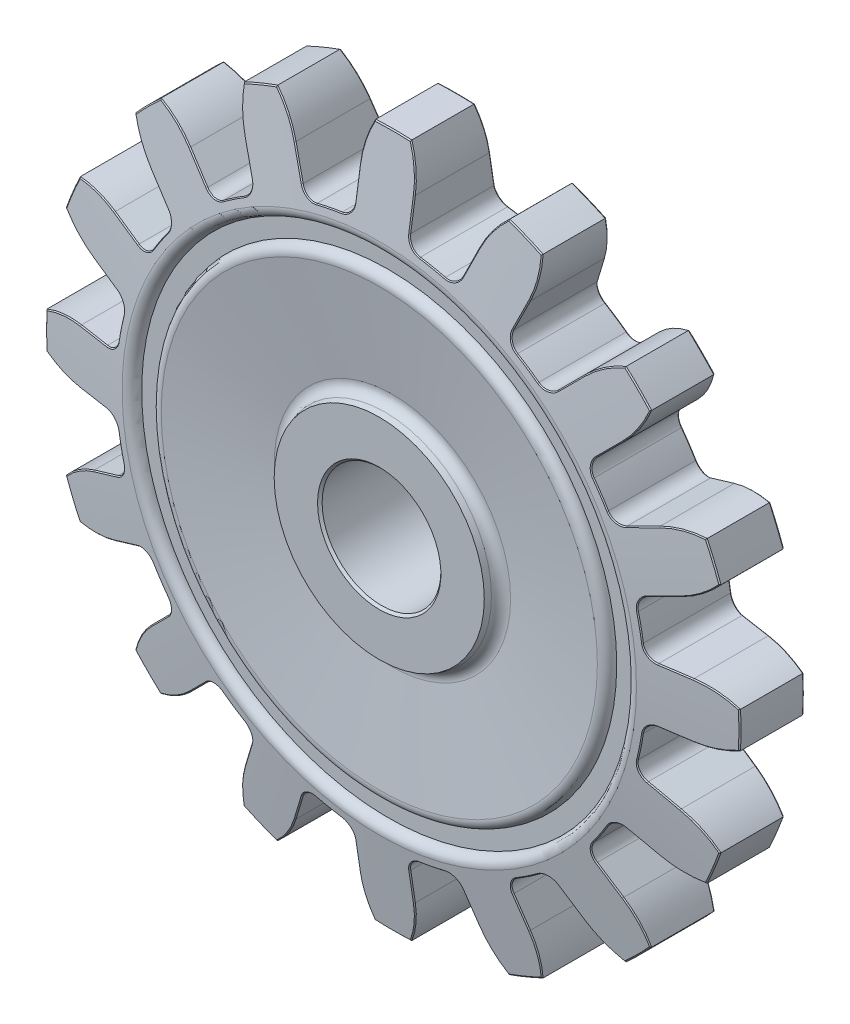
SolidWorks part; units mm, degrees
ref_plane "Спереди" through (0, 0, 0) normal (0, 0, 1) x (1, 0, 0)
ref_plane "Сверху" through (0, 0, 0) normal (0, 1, 0) x (1, 0, 0)
ref_plane "Справа" through (0, 0, 0) normal (1, 0, 0) x (0, 0, -1)
sketch "Эскиз2" plane through (0, 0, 0) normal (1, 0, 0) x (0, 0, -1)
  line L0 (-9.4803, 0) -> (8.8412, 0) construction
  line L1 (-5, 6.5) -> (5, 6.5)
  line L2 (5, 6.5) -> (5, 11.5)
  line L3 (-3.5, 38) -> (3.5, 38)
  line L4 (0, 0) -> (0, 38) construction
  line L5 (4, 27) -> (4, 25)
  line L6 (5, 11.5) -> (5, 40.25) construction
  line L7 (3.5, 38) -> (4.9888, 28.1494)
  line L8 (5, 11.5) -> (4.3844, 11.6707)
  line L9 (4.9914, 23.8695) -> (3.5512, 12.9296)
  line L10 (-5, 6.5) -> (-5, 11.5)
  line L11 (-5, 11.5) -> (-4.3844, 11.6707)
  line L12 (-4.9914, 23.8695) -> (-3.5512, 12.9296)
  line L13 (-4, 27) -> (-4, 25)
  line L14 (-3.5, 38) -> (-4.9888, 28.1494)
  arc A0 (4, 27) -> (4.9888, 28.1494) centre (4, 28) ccw
  arc A1 (4.9914, 23.8695) -> (4, 25) centre (4, 24) ccw
  arc A2 (3.5512, 12.9296) -> (4.3844, 11.6707) centre (4.6919, 12.7794) ccw
  arc A3 (-3.5512, 12.9296) -> (-4.3844, 11.6707) centre (-4.6919, 12.7794) cw
  arc A4 (-4.9914, 23.8695) -> (-4, 25) centre (-4, 24) cw
  arc A5 (-4, 27) -> (-4.9888, 28.1494) centre (-4, 28) cw
  point P19 (0, 6.5)
  dimension "D8" = 2
  dimension "D1" = 6.5
  dimension "D2" = 11.5
  dimension "D3" = 5
  dimension "D4" = 38
  dimension "D5" = 3.5
  dimension "D6" = 2
  dimension "D7" = 11
  dimension "D9" = 4
  dimension "D10" = 15.5
  dimension "D11" = 7.5
  dimension "D12" = 12.7794
revolve "Повернуть1" add sketch "Эскиз2" angle 360 about L0
sketch "Эскиз3" plane through (0, 0, 0) normal (0, 0, 1) x (1, 0, 0)
  line L0 (0, 42.1478) -> (0, 0) construction
  line L1 (0, 0) -> (7, 33.527) construction
  line L2 (3, 33.527) -> (3, 30.1662)
  line L3 (-3, 33.527) -> (-3, 30.1662)
  line L4 (15.6019, 29.8269) -> (14.3157, 26.7219)
  line L5 (10.0586, 32.123) -> (8.7725, 29.018)
  line L6 (25.8285, 21.5859) -> (23.452, 19.2094)
  line L7 (21.5859, 25.8285) -> (19.2094, 23.452)
  line L8 (32.123, 10.0586) -> (29.018, 8.7725)
  line L9 (29.8269, 15.6019) -> (26.7219, 14.3157)
  line L10 (33.527, -3) -> (30.1662, -3)
  line L11 (33.527, 3) -> (30.1662, 3)
  line L12 (29.8269, -15.6019) -> (26.7219, -14.3157)
  line L13 (32.123, -10.0586) -> (29.018, -8.7725)
  line L14 (21.5859, -25.8285) -> (19.2094, -23.452)
  line L15 (25.8285, -21.5859) -> (23.452, -19.2094)
  line L16 (10.0586, -32.123) -> (8.7725, -29.018)
  line L17 (15.6019, -29.8269) -> (14.3157, -26.7219)
  line L18 (-3, -33.527) -> (-3, -30.1662)
  line L19 (3, -33.527) -> (3, -30.1662)
  line L20 (-15.6019, -29.8269) -> (-14.3157, -26.7219)
  line L21 (-10.0586, -32.123) -> (-8.7725, -29.018)
  line L22 (-25.8285, -21.5859) -> (-23.452, -19.2094)
  line L23 (-21.5859, -25.8285) -> (-19.2094, -23.452)
  line L24 (-32.123, -10.0586) -> (-29.018, -8.7725)
  line L25 (-29.8269, -15.6019) -> (-26.7219, -14.3157)
  line L26 (-33.527, 3) -> (-30.1662, 3)
  line L27 (-33.527, -3) -> (-30.1662, -3)
  line L28 (-29.8269, 15.6019) -> (-26.7219, 14.3157)
  line L29 (-32.123, 10.0586) -> (-29.018, 8.7725)
  line L30 (-21.5859, 25.8285) -> (-19.2094, 23.452)
  line L31 (-25.8285, 21.5859) -> (-23.452, 19.2094)
  line L32 (-10.0586, 32.123) -> (-8.7725, 29.018)
  line L33 (-15.6019, 29.8269) -> (-14.3157, 26.7219)
  circle A0 centre (0, 0) radius 34.25 construction
  arc A1 (1.9692, 37.9489) -> (3, 33.527) centre (-7, 33.527) cw
  circle A2 centre (0, 0) radius 38 construction
  arc A3 (3, 30.1662) -> (4.2787, 28.6826) centre (4.5, 30.1662) ccw
  arc A4 (1.9692, 37.9489) -> (-1.9692, 37.9489) centre (0, 0) ccw
  arc A5 (-1.9692, 37.9489) -> (-3, 33.527) centre (7, 33.527) ccw
  arc A6 (-3, 30.1662) -> (-4.2787, 28.6826) centre (-4.5, 30.1662) cw
  arc A7 (16.3417, 34.3067) -> (12.7031, 35.8138) centre (0, 0) ccw
  arc A8 (12.7031, 35.8138) -> (10.0586, 32.123) centre (19.2974, 28.2962) ccw
  arc A9 (16.3417, 34.3067) -> (15.6019, 29.8269) centre (6.3631, 33.6537) cw
  arc A10 (14.3157, 26.7219) -> (14.9294, 24.8619) centre (15.7016, 26.1479) ccw
  arc A11 (8.7725, 29.018) -> (7.0234, 28.1367) centre (7.3866, 29.592) cw
  arc A12 (28.2264, 25.4415) -> (25.4415, 28.2264) centre (0, 0) ccw
  arc A13 (25.4415, 28.2264) -> (21.5859, 25.8285) centre (28.6569, 18.7575) ccw
  arc A14 (28.2264, 25.4415) -> (25.8285, 21.5859) centre (18.7575, 28.6569) cw
  arc A15 (23.452, 19.2094) -> (23.3072, 17.2562) centre (24.5127, 18.1487) ccw
  arc A16 (19.2094, 23.452) -> (17.2562, 23.3072) centre (18.1487, 24.5127) cw
  arc A17 (35.8138, 12.7031) -> (34.3067, 16.3417) centre (0, 0) ccw
  arc A18 (34.3067, 16.3417) -> (29.8269, 15.6019) centre (33.6537, 6.3631) ccw
  arc A19 (35.8138, 12.7031) -> (32.123, 10.0586) centre (28.2962, 19.2974) cw
  arc A20 (29.018, 8.7725) -> (28.1367, 7.0234) centre (29.592, 7.3866) ccw
  arc A21 (26.7219, 14.3157) -> (24.8619, 14.9294) centre (26.1479, 15.7016) cw
  arc A22 (37.9489, -1.9692) -> (37.9489, 1.9692) centre (0, 0) ccw
  arc A23 (37.9489, 1.9692) -> (33.527, 3) centre (33.527, -7) ccw
  arc A24 (37.9489, -1.9692) -> (33.527, -3) centre (33.527, 7) cw
  arc A25 (30.1662, -3) -> (28.6826, -4.2787) centre (30.1662, -4.5) ccw
  arc A26 (30.1662, 3) -> (28.6826, 4.2787) centre (30.1662, 4.5) cw
  arc A27 (34.3067, -16.3417) -> (35.8138, -12.7031) centre (0, 0) ccw
  arc A28 (35.8138, -12.7031) -> (32.123, -10.0586) centre (28.2962, -19.2974) ccw
  arc A29 (34.3067, -16.3417) -> (29.8269, -15.6019) centre (33.6537, -6.3631) cw
  arc A30 (26.7219, -14.3157) -> (24.8619, -14.9294) centre (26.1479, -15.7016) ccw
  arc A31 (29.018, -8.7725) -> (28.1367, -7.0234) centre (29.592, -7.3866) cw
  arc A32 (25.4415, -28.2264) -> (28.2264, -25.4415) centre (0, 0) ccw
  arc A33 (28.2264, -25.4415) -> (25.8285, -21.5859) centre (18.7575, -28.6569) ccw
  arc A34 (25.4415, -28.2264) -> (21.5859, -25.8285) centre (28.6569, -18.7575) cw
  arc A35 (19.2094, -23.452) -> (17.2562, -23.3072) centre (18.1487, -24.5127) ccw
  arc A36 (23.452, -19.2094) -> (23.3072, -17.2562) centre (24.5127, -18.1487) cw
  arc A37 (12.7031, -35.8138) -> (16.3417, -34.3067) centre (0, 0) ccw
  arc A38 (16.3417, -34.3067) -> (15.6019, -29.8269) centre (6.3631, -33.6537) ccw
  arc A39 (12.7031, -35.8138) -> (10.0586, -32.123) centre (19.2974, -28.2962) cw
  arc A40 (8.7725, -29.018) -> (7.0234, -28.1367) centre (7.3866, -29.592) ccw
  arc A41 (14.3157, -26.7219) -> (14.9294, -24.8619) centre (15.7016, -26.1479) cw
  arc A42 (-1.9692, -37.9489) -> (1.9692, -37.9489) centre (0, 0) ccw
  arc A43 (1.9692, -37.9489) -> (3, -33.527) centre (-7, -33.527) ccw
  arc A44 (-1.9692, -37.9489) -> (-3, -33.527) centre (7, -33.527) cw
  arc A45 (-3, -30.1662) -> (-4.2787, -28.6826) centre (-4.5, -30.1662) ccw
  arc A46 (3, -30.1662) -> (4.2787, -28.6826) centre (4.5, -30.1662) cw
  arc A47 (-16.3417, -34.3067) -> (-12.7031, -35.8138) centre (0, 0) ccw
  arc A48 (-12.7031, -35.8138) -> (-10.0586, -32.123) centre (-19.2974, -28.2962) ccw
  arc A49 (-16.3417, -34.3067) -> (-15.6019, -29.8269) centre (-6.3631, -33.6537) cw
  arc A50 (-14.3157, -26.7219) -> (-14.9294, -24.8619) centre (-15.7016, -26.1479) ccw
  arc A51 (-8.7725, -29.018) -> (-7.0234, -28.1367) centre (-7.3866, -29.592) cw
  arc A52 (-28.2264, -25.4415) -> (-25.4415, -28.2264) centre (0, 0) ccw
  arc A53 (-25.4415, -28.2264) -> (-21.5859, -25.8285) centre (-28.6569, -18.7575) ccw
  arc A54 (-28.2264, -25.4415) -> (-25.8285, -21.5859) centre (-18.7575, -28.6569) cw
  arc A55 (-23.452, -19.2094) -> (-23.3072, -17.2562) centre (-24.5127, -18.1487) ccw
  arc A56 (-19.2094, -23.452) -> (-17.2562, -23.3072) centre (-18.1487, -24.5127) cw
  arc A57 (-35.8138, -12.7031) -> (-34.3067, -16.3417) centre (0, 0) ccw
  arc A58 (-34.3067, -16.3417) -> (-29.8269, -15.6019) centre (-33.6537, -6.3631) ccw
  arc A59 (-35.8138, -12.7031) -> (-32.123, -10.0586) centre (-28.2962, -19.2974) cw
  arc A60 (-29.018, -8.7725) -> (-28.1367, -7.0234) centre (-29.592, -7.3866) ccw
  arc A61 (-26.7219, -14.3157) -> (-24.8619, -14.9294) centre (-26.1479, -15.7016) cw
  arc A62 (-37.9489, 1.9692) -> (-37.9489, -1.9692) centre (0, 0) ccw
  arc A63 (-37.9489, -1.9692) -> (-33.527, -3) centre (-33.527, 7) ccw
  arc A64 (-37.9489, 1.9692) -> (-33.527, 3) centre (-33.527, -7) cw
  arc A65 (-30.1662, 3) -> (-28.6826, 4.2787) centre (-30.1662, 4.5) ccw
  arc A66 (-30.1662, -3) -> (-28.6826, -4.2787) centre (-30.1662, -4.5) cw
  arc A67 (-34.3067, 16.3417) -> (-35.8138, 12.7031) centre (0, 0) ccw
  arc A68 (-35.8138, 12.7031) -> (-32.123, 10.0586) centre (-28.2962, 19.2974) ccw
  arc A69 (-34.3067, 16.3417) -> (-29.8269, 15.6019) centre (-33.6537, 6.3631) cw
  arc A70 (-26.7219, 14.3157) -> (-24.8619, 14.9294) centre (-26.1479, 15.7016) ccw
  arc A71 (-29.018, 8.7725) -> (-28.1367, 7.0234) centre (-29.592, 7.3866) cw
  arc A72 (-25.4415, 28.2264) -> (-28.2264, 25.4415) centre (0, 0) ccw
  arc A73 (-28.2264, 25.4415) -> (-25.8285, 21.5859) centre (-18.7575, 28.6569) ccw
  arc A74 (-25.4415, 28.2264) -> (-21.5859, 25.8285) centre (-28.6569, 18.7575) cw
  arc A75 (-19.2094, 23.452) -> (-17.2562, 23.3072) centre (-18.1487, 24.5127) ccw
  arc A76 (-23.452, 19.2094) -> (-23.3072, 17.2562) centre (-24.5127, 18.1487) cw
  arc A77 (-12.7031, 35.8138) -> (-16.3417, 34.3067) centre (0, 0) ccw
  arc A78 (-16.3417, 34.3067) -> (-15.6019, 29.8269) centre (-6.3631, 33.6537) ccw
  arc A79 (-12.7031, 35.8138) -> (-10.0586, 32.123) centre (-19.2974, 28.2962) cw
  arc A80 (-8.7725, 29.018) -> (-7.0234, 28.1367) centre (-7.3866, 29.592) ccw
  arc A81 (-14.3157, 26.7219) -> (-14.9294, 24.8619) centre (-15.7016, 26.1479) cw
  arc A82 (7.0234, 28.1367) -> (4.2787, 28.6826) centre (0, 0) ccw
  arc A83 (17.2562, 23.3072) -> (14.9294, 24.8619) centre (0, 0) ccw
  arc A84 (-14.9294, 24.8619) -> (-17.2562, 23.3072) centre (0, 0) ccw
  arc A85 (-23.3072, 17.2562) -> (-24.8619, 14.9294) centre (0, 0) ccw
  arc A86 (-28.1367, 7.0234) -> (-28.6826, 4.2787) centre (0, 0) ccw
  arc A87 (-28.6826, -4.2787) -> (-28.1367, -7.0234) centre (0, 0) ccw
  arc A88 (-24.8619, -14.9294) -> (-23.3072, -17.2562) centre (0, 0) ccw
  arc A89 (-17.2562, -23.3072) -> (-14.9294, -24.8619) centre (0, 0) ccw
  arc A90 (-7.0234, -28.1367) -> (-4.2787, -28.6826) centre (0, 0) ccw
  arc A91 (4.2787, -28.6826) -> (7.0234, -28.1367) centre (0, 0) ccw
  arc A92 (14.9294, -24.8619) -> (17.2562, -23.3072) centre (0, 0) ccw
  arc A93 (23.3072, -17.2562) -> (24.8619, -14.9294) centre (0, 0) ccw
  arc A94 (28.1367, -7.0234) -> (28.6826, -4.2787) centre (0, 0) ccw
  arc A95 (28.6826, 4.2787) -> (28.1367, 7.0234) centre (0, 0) ccw
  arc A96 (24.8619, 14.9294) -> (23.3072, 17.2562) centre (0, 0) ccw
  arc A100 (-4.2787, 28.6826) -> (-7.0234, 28.1367) centre (0, 0) ccw
  point P15 (3, 28.8444)
  point P18 (-3, 28.8444)
  dimension "D1" = 68.5
  dimension "D3" = 3
  dimension "D4" = 29
  dimension "D6" = 16
  dimension "D5" = 10
  dimension "D2" = 1.5
extrude "Вырез-Вытянуть1" cut sketch "Эскиз3" against normal mid plane 10 flip side to cut
chamfer "Фаска1" distance 0.25 angle 45 2 edges at (6.5, 0, 5) (6.5, 0, -5)
chamfer "Фаска2" distance 0.1 angle 45 256 edges at (14.542, 35.1074, -3.5) (10.5707, 33.1793, -3.9802) (8.1024, 28.2738, -4.798) (5.6576, 28.4428, -4.8602) (3.408, 29.1378, -4.8094) (2.4263, 36.8653, -3.6594) (0, 38, -3.5) (-2.9311, 34.6989, -3.9802) (-3.3343, 29.2222, -4.798) (-5.6576, 28.4428, -4.8602) (-8.0019, 28.224, -4.8094) (-11.8661, 34.9876, -3.6594) (-14.542, 35.1074, -3.5) (-15.9867, 30.9359, -3.9802) (-14.2633, 25.7218, -4.798) (-16.1115, 24.1126, -4.8602) (-18.1936, 23.0134, -4.8094) (-24.3519, 27.7834, -3.6594) (-26.8701, 26.8701, -3.5) (-26.6084, 22.4632, -3.9802) (-23.0209, 18.3056, -4.798) (-24.1126, 16.1115, -4.8602) (-25.6156, 14.2992, -4.8094) (-33.1306, 16.3494, -3.6594) (-35.1074, 14.542, -3.5) (-33.1793, 10.5707, -3.9802) (-28.2738, 8.1024, -4.798) (-28.4428, 5.6576, -4.8602) (-29.1378, 3.408, -4.8094) (-36.8653, 2.4263, -3.6594) (-38, 0, -3.5) (-34.6989, -2.9311, -3.9802) (-29.2222, -3.3343, -4.798) (-28.4428, -5.6576, -4.8602) (-28.224, -8.0019, -4.8094) (-34.9876, -11.8661, -3.6594) (-35.1074, -14.542, -3.5) (-30.9359, -15.9867, -3.9802) (-25.7218, -14.2633, -4.798) (-24.1126, -16.1115, -4.8602) (-23.0134, -18.1936, -4.8094) (-27.7834, -24.3519, -3.6594) (-26.8701, -26.8701, -3.5) (-22.4632, -26.6084, -3.9802) (-18.3056, -23.0209, -4.798) (-16.1115, -24.1126, -4.8602) (-14.2992, -25.6156, -4.8094) (-16.3494, -33.1306, -3.6594) (-14.542, -35.1074, -3.5) (-10.5707, -33.1793, -3.9802) (-8.1024, -28.2738, -4.798) (-5.6576, -28.4428, -4.8602) (-3.408, -29.1378, -4.8094) (-2.4263, -36.8653, -3.6594) (0, -38, -3.5) (2.9311, -34.6989, -3.9802) (3.3343, -29.2222, -4.798) (5.6576, -28.4428, -4.8602) (8.0019, -28.224, -4.8094) (11.8661, -34.9876, -3.6594) (14.542, -35.1074, -3.5) (15.9867, -30.9359, -3.9802) (14.2633, -25.7218, -4.798) (16.1115, -24.1126, -4.8602) (18.1936, -23.0134, -4.8094) (24.3519, -27.7834, -3.6594) (26.8701, -26.8701, -3.5) (26.6084, -22.4632, -3.9802) (23.0209, -18.3056, -4.798) (24.1126, -16.1115, -4.8602) (25.6156, -14.2992, -4.8094) (33.1306, -16.3494, -3.6594) (35.1074, -14.542, -3.5) (33.1793, -10.5707, -3.9802) (28.2738, -8.1024, -4.798) (28.4428, -5.6576, -4.8602) (29.1378, -3.408, -4.8094) (36.8653, -2.4263, -3.6594) (38, 0, -3.5) (34.6989, 2.9311, -3.9802) (29.2222, 3.3343, -4.798) (28.4428, 5.6576, -4.8602) (28.224, 8.0019, -4.8094) (34.9876, 11.8661, -3.6594) (35.1074, 14.542, -3.5) (30.9359, 15.9867, -3.9802) (25.7218, 14.2633, -4.798) (24.1126, 16.1115, -4.8602) (23.0134, 18.1936, -4.8094) (27.7834, 24.3519, -3.6594) (26.8701, 26.8701, -3.5) (22.4632, 26.6084, -3.9802) (18.3056, 23.0209, -4.798) (16.1115, 24.1126, -4.8602) (14.2992, 25.6156, -4.8094) (16.3494, 33.1306, -3.6594) (26.8701, 26.8701, 3.5) (26.6084, 22.4632, 3.9802) (23.0209, 18.3056, 4.798) (24.1126, 16.1115, 4.8602) (25.6156, 14.2992, 4.8094) (33.1306, 16.3494, 3.6594) (35.1074, 14.542, 3.5) (33.1793, 10.5707, 3.9802) (28.2738, 8.1024, 4.798) (28.4428, 5.6576, 4.8602) (29.1378, 3.408, 4.8094) (36.8653, 2.4263, 3.6594) (38, 0, 3.5) (34.6989, -2.9311, 3.9802) (29.2222, -3.3343, 4.798) (28.4428, -5.6576, 4.8602) (28.224, -8.0019, 4.8094) (34.9876, -11.8661, 3.6594) (35.1074, -14.542, 3.5) (30.9359, -15.9867, 3.9802) (25.7218, -14.2633, 4.798) (24.1126, -16.1115, 4.8602) (23.0134, -18.1936, 4.8094) (27.7834, -24.3519, 3.6594) (26.8701, -26.8701, 3.5) (22.4632, -26.6084, 3.9802) (18.3056, -23.0209, 4.798) (16.1115, -24.1126, 4.8602) (14.2992, -25.6156, 4.8094) (16.3494, -33.1306, 3.6594) (14.542, -35.1074, 3.5) (10.5707, -33.1793, 3.9802) (8.1024, -28.2738, 4.798) (5.6576, -28.4428, 4.8602) (3.408, -29.1378, 4.8094) (2.4263, -36.8653, 3.6594) (0, -38, 3.5) (-2.9311, -34.6989, 3.9802) (-3.3343, -29.2222, 4.798) (-5.6576, -28.4428, 4.8602) (-8.0019, -28.224, 4.8094) (-11.8661, -34.9876, 3.6594) (-14.542, -35.1074, 3.5) (-15.9867, -30.9359, 3.9802) (-14.2633, -25.7218, 4.798) (-16.1115, -24.1126, 4.8602) (-18.1936, -23.0134, 4.8094) (-24.3519, -27.7834, 3.6594) (-26.8701, -26.8701, 3.5) (-26.6084, -22.4632, 3.9802) (-23.0209, -18.3056, 4.798) (-24.1126, -16.1115, 4.8602) (-25.6156, -14.2992, 4.8094) (-33.1306, -16.3494, 3.6594) (-35.1074, -14.542, 3.5) (-33.1793, -10.5707, 3.9802) (-28.2738, -8.1024, 4.798) (-28.4428, -5.6576, 4.8602) (-29.1378, -3.408, 4.8094) (-36.8653, -2.4263, 3.6594) (-38, 0, 3.5) (-34.6989, 2.9311, 3.9802) (-29.2222, 3.3343, 4.798) (-28.4428, 5.6576, 4.8602) (-28.224, 8.0019, 4.8094) (-34.9876, 11.8661, 3.6594) (-35.1074, 14.542, 3.5) (-30.9359, 15.9867, 3.9802) (-25.7218, 14.2633, 4.798) (-24.1126, 16.1115, 4.8602) (-23.0134, 18.1936, 4.8094) (-27.7834, 24.3519, 3.6594) (-26.8701, 26.8701, 3.5) (-22.4632, 26.6084, 3.9802) (-18.3056, 23.0209, 4.798) (-16.1115, 24.1126, 4.8602) (-14.2992, 25.6156, 4.8094) (-16.3494, 33.1306, 3.6594) (-14.542, 35.1074, 3.5) (-10.5707, 33.1793, 3.9802) (-8.1024, 28.2738, 4.798) (-5.6576, 28.4428, 4.8602) (-3.408, 29.1378, 4.8094) (-2.4263, 36.8653, 3.6594) (0, 38, 3.5) (2.9311, 34.6989, 3.9802) (3.3343, 29.2222, 4.798) (5.6576, 28.4428, 4.8602) (8.0019, 28.224, 4.8094) (11.8661, 34.9876, 3.6594) (14.542, 35.1074, 3.5) (24.3519, 27.7834, 3.6594) (18.1936, 23.0134, 4.8094) (16.1115, 24.1126, 4.8602) (14.2633, 25.7218, 4.798) (15.9867, 30.9359, 3.9802)
